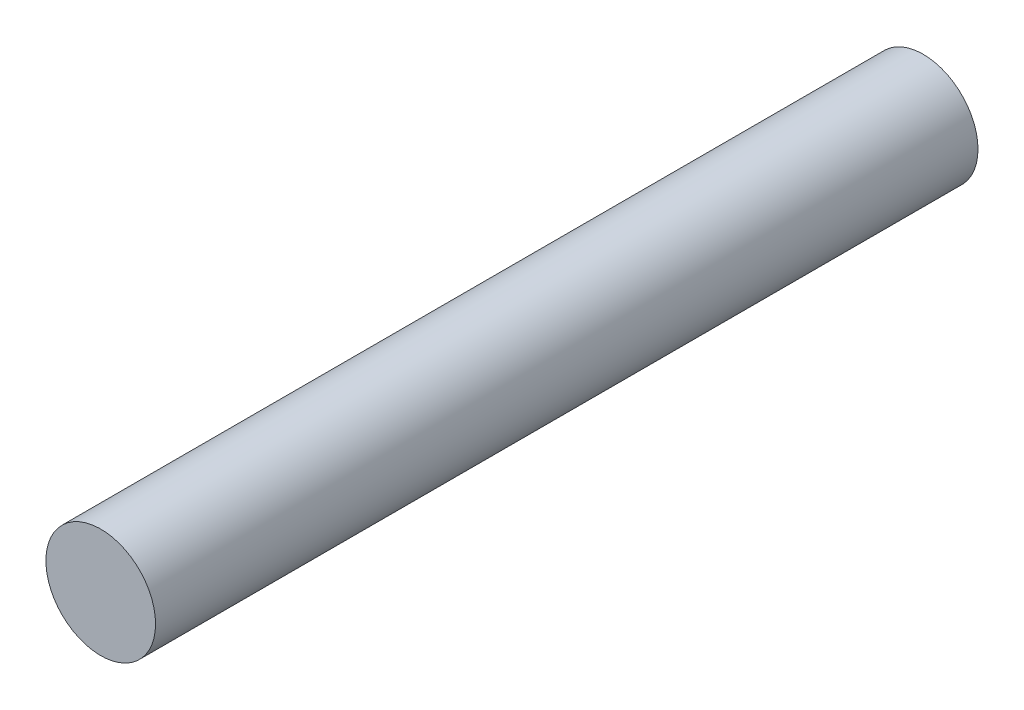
SolidWorks part; units mm, degrees
ref_plane "Ebene vorne" through (0, 0, 0) normal (0, 0, 1) x (1, 0, 0)
ref_plane "Ebene oben" through (0, 0, 0) normal (0, 1, 0) x (1, 0, 0)
ref_plane "Ebene rechts" through (0, 0, 0) normal (1, 0, 0) x (0, 0, -1)
sketch "Skizze1" plane through (0, 0, 0) normal (0, 0, 1) x (1, 0, 0)
  circle A0 centre (0, 0) radius 20
  dimension "D1" = 40
extrude "Linear austragen1" add sketch "Skizze1" along normal blind 300
